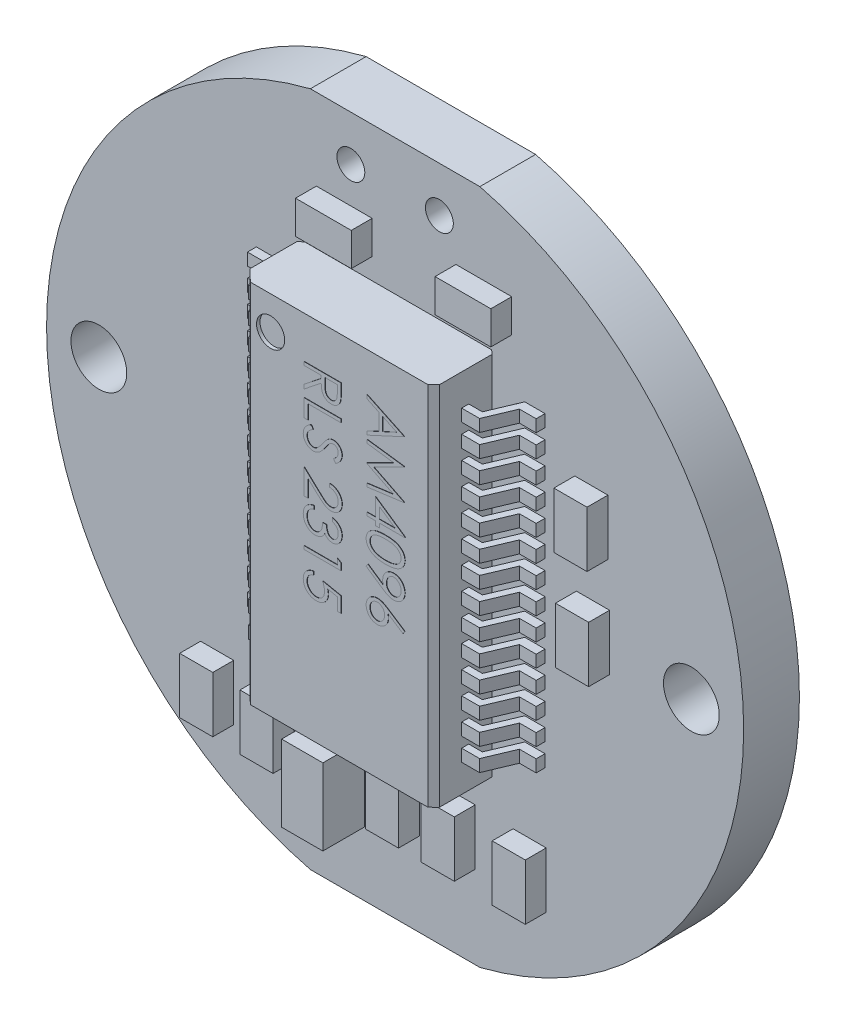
SolidWorks part; units mm, degrees
ref_plane "Plane1" through (0, 0, 0) normal (0, 0, 1) x (1, 0, 0)
ref_plane "Plane2" through (0, 0, 0) normal (0, 1, 0) x (1, 0, 0)
ref_plane "Plane3" through (0, 0, 0) normal (1, 0, 0) x (0, 0, -1)
sketch "Sketch1" plane through (0, 0, 0) normal (0, 0, 1) x (1, 0, 0)
  line L0 (7.9685, 8.8978) -> (9.3019, 8.8978)
  line L1 (7.9685, 9.7978) -> (2.3685, 9.7978)
  line L2 (7.9685, 9.7978) -> (7.9685, 8.8978)
  line L3 (7.9685, -0.7022) -> (2.3685, -0.7022)
  line L4 (2.3685, 9.7978) -> (2.3685, 8.8978)
  line L5 (7.9685, 9.7978) -> (2.3685, -0.7022) construction
  line L6 (7.9685, -0.7022) -> (2.3685, 9.7978) construction
  line L7 (1.0185, 8.8978) -> (2.3685, 8.8978)
  line L8 (1.0185, 8.8978) -> (1.0185, 8.5478)
  line L9 (1.0185, 8.5478) -> (2.3685, 8.5478)
  line L10 (2.3685, 8.5478) -> (2.3685, 8.2478)
  line L11 (7.9685, 8.5478) -> (7.9685, 8.2478)
  line L13 (9.3019, 8.8978) -> (9.3019, 8.5478)
  line L14 (7.9685, 8.5478) -> (9.3019, 8.5478)
  line L16 (7.9685, 7.8978) -> (9.3019, 7.8978)
  line L17 (9.3019, 8.2478) -> (9.3019, 7.8978)
  line L18 (7.9685, 7.5978) -> (9.3019, 7.5978)
  line L19 (7.9685, 7.2478) -> (7.9685, 6.9478)
  line L20 (7.9685, 7.2478) -> (9.3019, 7.2478)
  line L21 (9.3019, 7.5978) -> (9.3019, 7.2478)
  line L22 (7.9685, 6.9478) -> (9.3019, 6.9478)
  line L23 (7.9685, 6.5978) -> (7.9685, 6.2978)
  line L24 (7.9685, 6.5978) -> (9.3019, 6.5978)
  line L25 (9.3019, 6.9478) -> (9.3019, 6.5978)
  line L26 (7.9685, 6.2978) -> (9.3019, 6.2978)
  line L27 (7.9685, 7.8978) -> (7.9685, 7.5978)
  line L28 (7.9685, 5.9478) -> (9.3019, 5.9478)
  line L29 (9.3019, 6.2978) -> (9.3019, 5.9478)
  line L30 (7.9685, 5.6478) -> (9.3019, 5.6478)
  line L31 (7.9685, 5.2978) -> (7.9685, 4.9978)
  line L32 (7.9685, 5.2978) -> (9.3019, 5.2978)
  line L33 (9.3019, 5.6478) -> (9.3019, 5.2978)
  line L34 (7.9685, 4.9978) -> (9.3019, 4.9978)
  line L35 (7.9685, 4.6478) -> (7.9685, 4.3478)
  line L36 (7.9685, 4.6478) -> (9.3019, 4.6478)
  line L37 (9.3019, 4.9978) -> (9.3019, 4.6478)
  line L38 (7.9685, 4.3478) -> (9.3019, 4.3478)
  line L39 (7.9685, 5.9478) -> (7.9685, 5.6478)
  line L40 (7.9685, 3.9978) -> (9.3019, 3.9978)
  line L41 (9.3019, 4.3478) -> (9.3019, 3.9978)
  line L42 (7.9685, 3.6978) -> (9.3019, 3.6978)
  line L43 (7.9685, 3.3478) -> (7.9685, 3.0478)
  line L44 (7.9685, 3.3478) -> (9.3019, 3.3478)
  line L45 (9.3019, 3.6978) -> (9.3019, 3.3478)
  line L46 (7.9685, 3.0478) -> (9.3019, 3.0478)
  line L47 (7.9685, 3.9978) -> (7.9685, 3.6978)
  line L48 (7.9685, 2.6978) -> (9.3019, 2.6978)
  line L49 (9.3019, 3.0478) -> (9.3019, 2.6978)
  line L50 (7.9685, 2.3978) -> (9.3019, 2.3978)
  line L51 (7.9685, 8.2478) -> (9.3019, 8.2478)
  line L52 (7.9685, 2.0478) -> (9.3019, 2.0478)
  line L53 (9.3019, 2.3978) -> (9.3019, 2.0478)
  line L54 (7.9685, 1.7478) -> (9.3019, 1.7478)
  line L55 (7.9685, 0.7478) -> (7.9685, 0.4478)
  line L56 (7.9685, 1.3978) -> (9.3019, 1.3978)
  line L57 (9.3019, 1.7478) -> (9.3019, 1.3978)
  line L58 (7.9685, 1.0978) -> (9.3019, 1.0978)
  line L59 (7.9685, 1.3978) -> (7.9685, 1.0978)
  line L60 (7.9685, 2.0478) -> (7.9685, 1.7478)
  line L61 (9.3019, 1.0978) -> (9.3019, 0.7478)
  line L62 (7.9685, 0.4478) -> (9.3019, 0.4478)
  line L63 (7.9685, 0.0978) -> (7.9685, -0.7022)
  line L64 (7.9685, 0.0978) -> (9.3019, 0.0978)
  line L65 (9.3019, 0.4478) -> (9.3019, 0.0978)
  line L66 (1.0185, 8.2478) -> (2.3685, 8.2478)
  line L67 (1.0185, 8.2478) -> (1.0185, 7.8978)
  line L68 (1.0185, 7.8978) -> (2.3685, 7.8978)
  line L69 (2.3685, 7.8978) -> (2.3685, 7.5978)
  line L70 (1.0185, 7.5978) -> (2.3685, 7.5978)
  line L71 (1.0185, 7.5978) -> (1.0185, 7.2478)
  line L72 (1.0185, 7.2478) -> (2.3685, 7.2478)
  line L73 (2.3685, 7.2478) -> (2.3685, 6.9478)
  line L74 (1.0185, 6.9478) -> (2.3685, 6.9478)
  line L75 (1.0185, 6.9478) -> (1.0185, 6.5978)
  line L76 (1.0185, 6.5978) -> (2.3685, 6.5978)
  line L77 (2.3685, 5.9478) -> (2.3685, 5.6478)
  line L78 (1.0185, 6.2978) -> (2.3685, 6.2978)
  line L79 (1.0185, 6.2978) -> (1.0185, 5.9478)
  line L80 (1.0185, 5.9478) -> (2.3685, 5.9478)
  line L81 (2.3685, 5.2978) -> (2.3685, 4.9978)
  line L82 (1.0185, 5.6478) -> (2.3685, 5.6478)
  line L83 (1.0185, 5.6478) -> (1.0185, 5.2978)
  line L84 (1.0185, 5.2978) -> (2.3685, 5.2978)
  line L85 (2.3685, 4.6478) -> (2.3685, 4.3478)
  line L86 (1.0185, 4.9978) -> (2.3685, 4.9978)
  line L87 (1.0185, 4.9978) -> (1.0185, 4.6478)
  line L88 (1.0185, 4.6478) -> (2.3685, 4.6478)
  line L89 (2.3685, 3.9978) -> (2.3685, 3.6978)
  line L90 (1.0185, 4.3478) -> (2.3685, 4.3478)
  line L91 (1.0185, 4.3478) -> (1.0185, 3.9978)
  line L92 (1.0185, 3.9978) -> (2.3685, 3.9978)
  line L93 (2.3685, 3.3478) -> (2.3685, 3.0478)
  line L94 (1.0185, 3.6978) -> (2.3685, 3.6978)
  line L95 (1.0185, 3.6978) -> (1.0185, 3.3478)
  line L96 (1.0185, 3.3478) -> (2.3685, 3.3478)
  line L97 (2.3685, 2.6978) -> (2.3685, 2.3978)
  line L98 (1.0185, 3.0478) -> (2.3685, 3.0478)
  line L99 (1.0185, 3.0478) -> (1.0185, 2.6978)
  line L100 (1.0185, 2.6978) -> (2.3685, 2.6978)
  line L101 (2.3685, 2.0478) -> (2.3685, 1.7478)
  line L102 (1.0185, 2.3978) -> (2.3685, 2.3978)
  line L103 (1.0185, 2.3978) -> (1.0185, 2.0478)
  line L104 (1.0185, 2.0478) -> (2.3685, 2.0478)
  line L105 (2.3685, 1.3978) -> (2.3685, 1.0978)
  line L106 (1.0185, 1.7478) -> (2.3685, 1.7478)
  line L107 (1.0185, 1.7478) -> (1.0185, 1.3978)
  line L108 (1.0185, 1.3978) -> (2.3685, 1.3978)
  line L109 (2.3685, 0.0978) -> (2.3685, -0.7022)
  line L110 (1.0185, 1.0978) -> (2.3685, 1.0978)
  line L111 (1.0185, 1.0978) -> (1.0185, 0.7478)
  line L112 (1.0185, 0.7478) -> (2.3685, 0.7478)
  line L113 (7.9685, 0.7478) -> (9.3019, 0.7478)
  line L114 (1.0185, 0.4478) -> (2.3685, 0.4478)
  line L115 (1.0185, 0.4478) -> (1.0185, 0.0978)
  line L116 (1.0185, 0.0978) -> (2.3685, 0.0978)
  line L117 (7.9685, 2.6978) -> (7.9685, 2.3978)
  line L118 (2.3685, 6.5978) -> (2.3685, 6.2978)
  line L119 (2.3685, 0.7478) -> (2.3685, 0.4478)
  line L187 (7.4885, 0.4478) -> (7.4885, 0.0978)
  line L188 (7.0185, 0.7478) -> (7.1952, 0.7478)
  line L189 (7.4885, 1.0978) -> (7.4885, 1.079)
  line L190 (7.4885, 1.7478) -> (7.4885, 1.3978)
  line L191 (7.4885, 3.0478) -> (7.4885, 2.6978)
  line L192 (7.4885, 2.3978) -> (7.4885, 2.0478)
  line L193 (7.4885, 3.6978) -> (7.4885, 3.3478)
  line L194 (7.4885, 4.3478) -> (7.4885, 3.9978)
  line L195 (7.4885, 4.9978) -> (7.4885, 4.6478)
  line L196 (7.4885, 5.6478) -> (7.4885, 5.2978)
  line L197 (7.4885, 6.2978) -> (7.4885, 5.9478)
  line L198 (7.4885, 6.9478) -> (7.4885, 6.5978)
  line L199 (7.4885, 7.5978) -> (7.4885, 7.2478)
  line L200 (7.0185, 8.2478) -> (7.1418, 8.2478)
  line L201 (7.4885, 8.0165) -> (7.4885, 7.8978)
  line L202 (7.0185, 8.5478) -> (7.3018, 8.5478)
  line L203 (7.4885, 8.8978) -> (7.4885, 8.5478)
  circle A0 centre (5.1685, 4.5478) radius 0.005
  dimension "D3" = 1.35
  dimension "D1" = 5.6
  dimension "D2" = 10.5
  dimension "D4" = 0.9
  dimension "D5" = 0.35
  dimension "D6" = 2
  dimension "D7" = 14
extrude "Base-Extrude" add sketch "Sketch1" along normal blind 1.86
sketch "Sketch5" plane through (0, 0, 1.86) normal (0, 0, 1) x (1, 0, 0)
  circle A0 centre (3.2885, 8.8458) radius 0.4042
extrude "Cut-Extrude5" cut sketch "Sketch5" against normal blind 0.1
sketch "Sketch15" plane through (0, 9.7978, 0) normal (0, 1, 0) x (1, 0, 0)
  line L0 (1.0185, -0.2554) -> (1.515, -0.2554)
  line L1 (1.0185, -1.86) -> (1.0185, 0) construction
  line L2 (1.515, -0.2554) -> (1.8543, -1.0602)
  line L3 (1.8543, -1.0602) -> (2.3685, -1.0602)
  line L4 (2.3685, -1.86) -> (2.3685, 0) construction
  line L5 (1.6176, 0) -> (1.9784, -0.8559)
  line L6 (2.3685, 0) -> (1.0185, 0) construction
  line L7 (1.9784, -0.8559) -> (2.3685, -0.8559)
  line L8 (2.3685, -0.8559) -> (2.3685, -0.1875)
  line L9 (2.3685, -1.86) -> (2.3685, 0) construction
  line L10 (2.3685, -0.1875) -> (2.4855, -0.0818)
  line L11 (2.4855, -0.0818) -> (7.8515, -0.0818)
  line L13 (7.9685, -1.86) -> (2.3685, -1.86) construction
  line L14 (2.3685, -1.0602) -> (2.3685, -1.5336)
  line L15 (1.0185, -0.2554) -> (0.5525, -0.2554)
  line L16 (0.5525, -0.2554) -> (0.5525, -2.3857)
  line L17 (0.5525, -2.3857) -> (2.6512, -2.3857)
  line L18 (9.7846, -2.3857) -> (7.7471, -2.3896)
  line L19 (9.7846, -0.2554) -> (9.7846, -2.3857)
  line L21 (7.9685, -1.0602) -> (7.9685, -1.6968)
  line L22 (7.9685, -0.1875) -> (7.8515, -0.0818)
  line L23 (7.9685, -0.8559) -> (7.9685, -0.1875)
  line L24 (8.3586, -0.8559) -> (7.9685, -0.8559)
  line L25 (8.7194, 0) -> (8.3586, -0.8559)
  line L26 (8.4827, -1.0602) -> (7.9685, -1.0602)
  line L27 (8.822, -0.2554) -> (8.4827, -1.0602)
  line L28 (9.7846, -0.2554) -> (8.822, -0.2554)
  line L29 (1.6176, 0) -> (8.7194, 0)
  line L30 (2.3685, -1.5336) -> (2.7064, -1.86)
  line L31 (2.7064, -1.86) -> (2.6512, -2.3857)
  line L33 (7.9685, -1.86) -> (7.9685, 0) construction
  line L34 (7.9685, -1.6968) -> (7.8028, -1.86)
  line L35 (7.8028, -1.86) -> (7.7471, -2.3896)
extrude "Cut-Extrude9" cut sketch "Sketch15" against normal blind 11
sketch "Sketch6" plane through (0, 0, 1.86) normal (0, 0, 1) x (1, 0, 0)
  line L0 (6.0658, 8.7382) -> (6.0658, 0.6216) construction
  text T0 "AM4096  RLS 2315" font "Century Gothic" height in points 4
extrude "Boss-Extrude1" add sketch "Sketch6" along normal blind 0.01
sketch "Sketch7" plane through (0, 0, 0) normal (0, 0, -1) x (-1, 0, 0)
  line L0 (-15, 5.0018) -> (5, 5.0018) construction
  line L1 (-5, 5.0018) -> (-5, 19.2518) construction
  line L2 (-19.25, 19.2518) -> (9.25, 19.2518) construction
  line L3 (-19.25, 19.2518) -> (-19.25, -9.2482) construction
  line L4 (-19.25, -9.2482) -> (9.25, -9.2482) construction
  line L5 (9.25, 19.2518) -> (9.25, -9.2482) construction
  line L6 (-5, 5.0018) -> (9.25, 5.0018) construction
  line L7 (-19.25, 19.2518) -> (9.25, -9.2482) construction
  line L8 (-19.25, -9.2482) -> (9.25, 19.2518) construction
  line L9 (3.5, 3.9018) -> (-13.5, 3.9018) construction
  line L10 (-2.569, 13.6018) -> (-7.431, 13.6018)
  line L11 (-2.569, -5.7982) -> (-7.431, -5.7982)
  circle A0 centre (-5, 5.0018) radius 10 construction
  circle A1 centre (-13.5, 5.0018) radius 0.1397 construction
  circle A2 centre (3.5, 5.0018) radius 0.8 construction
  circle A3 centre (-5, 5.0018) radius 15.5 construction
  circle A4 centre (-15.9602, 15.9619) radius 1.25 construction
  circle A5 centre (5.9602, 15.9619) radius 1.25 construction
  circle A6 centre (5.9602, -5.9584) radius 1.25 construction
  circle A7 centre (-15.9602, -5.9584) radius 1.25 construction
  circle A8 centre (5.9602, 15.9619) radius 0.75 construction
  circle A9 centre (-15.9602, -5.9584) radius 0.75 construction
  arc A10 (-2.569, -5.7982) -> (-2.569, 13.6018) centre (-5, 3.9018) ccw
  circle A11 centre (3.5, 3.9018) radius 0.8
  circle A12 centre (-13.5, 3.9018) radius 0.8
  arc A13 (-7.431, 13.6018) -> (-7.431, -5.7982) centre (-5, 3.9018) ccw
  circle A14 centre (-6.27, 12.3018) radius 0.4
  circle A15 centre (-3.73, 12.3018) radius 0.4
  dimension "D1" = 2.5
  dimension "D2" = 4
  dimension "D3" = 0.5
  dimension "D4" = 0.5
  dimension "D5" = 20
  dimension "D8" = 20
  dimension "D9" = 1.1
  dimension "D11" = 1.6
  dimension "D13" = 9.7
  dimension "D15" = 2.54
  dimension "D17" = 0.8
  dimension "D6" = 28.5
  dimension "D7" = 28.5
  dimension "D10" = 17
  dimension "D12" = 1.1
  dimension "D14" = 9.7
  dimension "D16" = 8.4
extrude "Extrude1" add sketch "Sketch7" along normal blind 1.6
sketch "Sketch12" plane through (0, 0, 0) normal (0, 0, 1) x (1, 0, 0)
  line L0 (2.944, -1.768) -> (4.1264, -1.768)
  line L1 (2.944, -1.768) -> (2.944, -3.9585)
  line L2 (2.944, -3.9585) -> (4.1264, -3.9585)
  line L3 (4.1264, -1.768) -> (4.1264, -3.9585)
  line L4 (2.7418, 11.2698) -> (4.3418, 11.2698)
  line L5 (2.7418, 11.2698) -> (2.7418, 10.3198)
  line L6 (2.7418, 10.3198) -> (4.3418, 10.3198)
  line L7 (4.3418, 11.2698) -> (4.3418, 10.3198)
  line L8 (-0.581, -1.6996) -> (0.369, -1.6996)
  line L9 (-0.581, -1.6996) -> (-0.581, -3.2996)
  line L10 (-0.581, -3.2996) -> (0.369, -3.2996)
  line L11 (0.369, -1.6996) -> (0.369, -3.2996)
  line L12 (1.1481, -1.7456) -> (2.0981, -1.7456)
  line L13 (1.1481, -1.7456) -> (1.1481, -3.3456)
  line L14 (1.1481, -3.3456) -> (2.0981, -3.3456)
  line L15 (2.0981, -1.7456) -> (2.0981, -3.3456)
  line L20 (10.155, 7.7742) -> (11.105, 7.7742)
  line L21 (10.155, 7.7742) -> (10.155, 6.1742)
  line L22 (10.155, 6.1742) -> (11.105, 6.1742)
  line L23 (11.105, 7.7742) -> (11.105, 6.1742)
  line L24 (8.3848, -1.8767) -> (9.3348, -1.8767)
  line L25 (8.3848, -1.8767) -> (8.3848, -3.4767)
  line L26 (8.3848, -3.4767) -> (9.3348, -3.4767)
  line L27 (9.3348, -1.8767) -> (9.3348, -3.4767)
  line L28 (4.7475, -1.8) -> (5.6975, -1.8)
  line L29 (4.7475, -1.8) -> (4.7475, -3.4)
  line L30 (4.7475, -3.4) -> (5.6975, -3.4)
  line L31 (5.6975, -1.8) -> (5.6975, -3.4)
  line L32 (6.3483, -1.8248) -> (7.2983, -1.8248)
  line L33 (6.3483, -1.8248) -> (6.3483, -3.4248)
  line L34 (6.3483, -3.4248) -> (7.2983, -3.4248)
  line L35 (7.2983, -1.8248) -> (7.2983, -3.4248)
  line L36 (6.7455, 11.3247) -> (8.3455, 11.3247)
  line L37 (6.7455, 11.3247) -> (6.7455, 10.3747)
  line L38 (6.7455, 10.3747) -> (8.3455, 10.3747)
  line L39 (8.3455, 11.3247) -> (8.3455, 10.3747)
  line L40 (10.2015, 4.9366) -> (11.1515, 4.9366)
  line L41 (10.2015, 4.9366) -> (10.2015, 3.3366)
  line L42 (10.2015, 3.3366) -> (11.1515, 3.3366)
  line L43 (11.1515, 4.9366) -> (11.1515, 3.3366)
  dimension "D1" = 1.6
  dimension "D2" = 0.95
extrude "Extrude6" add sketch "Sketch12" along normal blind 0.6
sketch "Sketch14" plane through (0, 0, -1.6) normal (0, 0, -1) x (-1, 0, 0)
  line L0 (3.5, 2.4018) -> (3.5, 5.4018) construction
  line L1 (-11.0073, -0.7594) -> (-9.9073, -0.7594)
  line L2 (-11.0073, -0.7594) -> (-11.0073, -3.2594)
  line L3 (-11.0073, -3.2594) -> (-9.9073, -3.2594)
  line L4 (-9.9073, -0.7594) -> (-9.9073, -3.2594)
  line L5 (2.3, 2.4018) -> (2.3, 5.4018)
  line L6 (-9.5073, -0.7594) -> (-8.4073, -0.7594)
  line L7 (-9.5073, -0.7594) -> (-9.5073, -3.2594)
  line L8 (-9.5073, -3.2594) -> (-8.4073, -3.2594)
  line L9 (-8.4073, -0.7594) -> (-8.4073, -3.2594)
  line L10 (-8.0073, -0.7594) -> (-6.9073, -0.7594)
  line L11 (-8.0073, -0.7594) -> (-8.0073, -3.2594)
  line L12 (-8.0073, -3.2594) -> (-6.9073, -3.2594)
  line L13 (-6.9073, -0.7594) -> (-6.9073, -3.2594)
  line L14 (-6.5073, -0.7594) -> (-5.4073, -0.7594)
  line L15 (-6.5073, -0.7594) -> (-6.5073, -3.2594)
  line L16 (-6.5073, -3.2594) -> (-5.4073, -3.2594)
  line L17 (-5.4073, -0.7594) -> (-5.4073, -3.2594)
  line L18 (-5.0073, -0.7594) -> (-3.9073, -0.7594)
  line L19 (-5.0073, -0.7594) -> (-5.0073, -3.2594)
  line L20 (-5.0073, -3.2594) -> (-3.9073, -3.2594)
  line L21 (-3.9073, -0.7594) -> (-3.9073, -3.2594)
  line L22 (-3.5073, -0.7594) -> (-2.4073, -0.7594)
  line L23 (-3.5073, -0.7594) -> (-3.5073, -3.2594)
  line L24 (-3.5073, -3.2594) -> (-2.4073, -3.2594)
  line L25 (-2.4073, -0.7594) -> (-2.4073, -3.2594)
  line L30 (-13.5, 2.4018) -> (-13.5, 5.4018) construction
  line L31 (-14.7, 2.4018) -> (-14.7, 5.4018)
  line L32 (-12.3, 2.4018) -> (-12.3, 5.4018)
  line L33 (-5, 3.9018) -> (-5, 8.8363) construction
  line L34 (4.7, 2.4018) -> (4.7, 5.4018)
  line L35 (-2.0073, -0.7594) -> (-0.9073, -0.7594)
  line L36 (-2.0073, -0.7594) -> (-2.0073, -3.2594)
  line L37 (-2.0073, -3.2594) -> (-0.9073, -3.2594)
  line L38 (-0.9073, -0.7594) -> (-0.9073, -3.2594)
  arc A0 (2.3, 2.4018) -> (4.7, 2.4018) centre (3.5, 2.4018) ccw
  arc A1 (4.7, 5.4018) -> (2.3, 5.4018) centre (3.5, 5.4018) ccw
  circle A3 centre (-13.5, 3.9018) radius 0.8
  circle A4 centre (-13.5, 3.9018) radius 0.8
  arc A5 (-14.7, 2.4018) -> (-12.3, 2.4018) centre (-13.5, 2.4018) ccw
  circle A6 centre (3.5, 3.9018) radius 0.8
  circle A7 centre (3.5, 3.9018) radius 0.8
  arc A8 (-12.3, 5.4018) -> (-14.7, 5.4018) centre (-13.5, 5.4018) ccw
  point P34 (-13.5, 3.9018)
  point P45 (3.5, 3.9018)
  dimension "D8" = 3
  dimension "D7" = 1.2
  dimension "D1" = 7
  dimension "D2" = 1.5
  dimension "D3" = 2.5
  dimension "D4" = 1.1
  dimension "D6" = 0
  dimension "D5" = 0
extrude "Boss-Extrude2" add sketch "Sketch14" along normal blind 0.05
sketch "Sketch18" plane through (0, 0, 0.6) normal (0, 0, 1) x (1, 0, 0)
  line L8 (2.944, -1.768) -> (2.944, -3.9585)
  line L9 (2.944, -3.9585) -> (4.1264, -3.9585)
  line L10 (4.1264, -3.9585) -> (4.1264, -1.768)
  line L11 (4.1264, -1.768) -> (2.944, -1.768)
  line L12 (2.944, -1.768) -> (2.944, -3.9585)
  line L13 (2.944, -3.9585) -> (4.1264, -3.9585)
  line L14 (4.1264, -3.9585) -> (4.1264, -1.768)
  line L15 (4.1264, -1.768) -> (2.944, -1.768)
  dimension "D1" = 0
extrude "Boss-Extrude4" add sketch "Sketch18" along normal blind 0.6
sketch "Sketch19" plane through (0, 0, -1.6) normal (0, 0, -1) x (-1, 0, 0)
  line L108 (-6.0833, 2.8224) -> (-6.0833, 3.2474)
  line L109 (-7.1993, 3.6474) -> (-7.1993, 3.2474)
  line L110 (-7.1993, 4.8974) -> (-7.1993, 4.4974)
  line L111 (-6.0833, 3.6474) -> (-6.0833, 4.4974)
  line L112 (-6.0833, 4.8974) -> (-6.0833, 5.7474)
  line L113 (-7.1993, 6.1474) -> (-7.1993, 5.7474)
  line L114 (-6.0833, 6.1474) -> (-6.0833, 6.9974)
  line L115 (-7.1993, 7.3974) -> (-7.1993, 6.9974)
  line L116 (-6.0833, 7.3974) -> (-6.0833, 7.8224)
  line L117 (-2.0996, 7.8224) -> (-2.0996, 7.3974)
  line L118 (-0.9993, 7.3974) -> (-0.9993, 6.9974)
  line L119 (-2.0996, 6.9974) -> (-2.0996, 6.1474)
  line L120 (-0.9993, 6.1474) -> (-0.9993, 5.7474)
  line L121 (-2.0996, 5.7474) -> (-2.0996, 4.8974)
  line L122 (-0.9993, 4.8974) -> (-0.9993, 4.4974)
  line L123 (-2.0996, 4.4974) -> (-2.0996, 3.6474)
  line L124 (-0.9993, 3.6474) -> (-0.9993, 3.2474)
  line L125 (-2.0996, 3.2474) -> (-2.0996, 2.8224)
  line L126 (-2.0996, 7.8224) -> (-6.0833, 7.8224)
  line L127 (-2.0996, 2.8224) -> (-6.0833, 2.8224)
  line L128 (-6.0833, 4.8974) -> (-7.1993, 4.8974)
  line L129 (-7.1993, 3.2474) -> (-6.0833, 3.2474)
  line L130 (-6.0833, 3.6474) -> (-7.1993, 3.6474)
  line L131 (-7.1993, 4.4974) -> (-6.0833, 4.4974)
  line L132 (-7.1993, 5.7474) -> (-6.0833, 5.7474)
  line L133 (-6.0833, 6.1474) -> (-7.1993, 6.1474)
  line L134 (-7.1993, 6.9974) -> (-6.0833, 6.9974)
  line L135 (-6.0833, 7.3974) -> (-7.1993, 7.3974)
  line L136 (-0.9993, 3.2474) -> (-2.0996, 3.2474)
  line L137 (-2.0996, 3.6474) -> (-0.9993, 3.6474)
  line L138 (-0.9993, 4.4974) -> (-2.0996, 4.4974)
  line L139 (-2.0996, 4.8974) -> (-0.9993, 4.8974)
  line L140 (-0.9993, 5.7474) -> (-2.0996, 5.7474)
  line L141 (-2.0996, 6.1474) -> (-0.9993, 6.1474)
  line L142 (-0.9993, 6.9974) -> (-2.0996, 6.9974)
  line L143 (-2.0996, 7.3974) -> (-0.9993, 7.3974)
extrude "Boss-Extrude5" add sketch "Sketch19" along normal blind 1.7
sketch "Sketch20" plane through (0, 2.8224, 0) normal (0, -1, 0) x (1, 0, 0)
  line L0 (2.0996, -3.3) -> (2.0996, -1.6) construction
  line L1 (6.0833, -3.3) -> (6.0833, -1.6) construction
  line L2 (-5, -1.6) -> (2.569, -1.6) construction
  line L22 (6.6964, -1.6) -> (1.5522, -1.6)
  line L23 (7.4317, -1.8504) -> (7.4317, -4.1802)
  line L24 (7.4317, -4.1802) -> (0.6061, -4.1802)
  line L25 (0.6061, -4.1802) -> (0.6061, -1.8504)
  line L26 (2.1993, -3.3539) -> (5.6993, -3.3539)
  line L27 (6.6993, -2.5039) -> (6.0833, -2.5039)
  line L28 (1.5495, -2.5039) -> (2.0996, -2.5039)
  line L29 (6.0833, -2.196) -> (6.4777, -2.196)
  line L30 (6.0833, -1.8504) -> (6.0833, -2.196)
  line L31 (6.0833, -2.9679) -> (5.6993, -3.3539)
  line L32 (6.0833, -1.8504) -> (2.0996, -1.8504)
  line L33 (2.0996, -1.8504) -> (2.0996, -2.196)
  line L34 (2.0996, -2.7576) -> (2.1993, -3.3539)
  line L35 (6.4777, -2.196) -> (6.6964, -1.6)
  line L36 (6.6993, -2.5039) -> (6.9391, -1.8504)
  line L37 (6.9391, -1.8504) -> (7.4317, -1.8504)
  line L38 (1.5495, -2.5039) -> (1.2713, -1.8504)
  line L39 (1.2713, -1.8504) -> (0.6061, -1.8504)
  line L40 (2.0996, -2.196) -> (1.7578, -2.196)
  line L41 (1.7578, -2.196) -> (1.5522, -1.6)
  line L42 (6.0833, -2.5039) -> (6.0833, -2.9679)
  line L43 (2.0996, -2.5039) -> (2.0996, -2.7576)
extrude "Cut-Extrude10" cut sketch "Sketch20" against normal blind 8
sketch "Sketch21" plane through (0, 0, -1.6) normal (0, 0, -1) x (-1, 0, 0)
  line L1 (-9.0378, 7.2175) -> (-8.1378, 7.2175)
  line L2 (-9.0378, 7.2175) -> (-9.0378, 5.6175)
  line L3 (-9.0378, 5.6175) -> (-8.1378, 5.6175)
  line L4 (-8.1378, 7.2175) -> (-8.1378, 5.6175)
  line L5 (-8.0569, 2.092) -> (-6.4569, 2.092)
  line L6 (-8.0569, 2.092) -> (-8.0569, 1.192)
  line L7 (-8.0569, 1.192) -> (-6.4569, 1.192)
  line L8 (-6.4569, 2.092) -> (-6.4569, 1.192)
  line L9 (-4.5007, 2.0646) -> (-2.9007, 2.0646)
  line L10 (-4.5007, 2.0646) -> (-4.5007, 1.1646)
  line L11 (-4.5007, 1.1646) -> (-2.9007, 1.1646)
  line L12 (-2.9007, 2.0646) -> (-2.9007, 1.1646)
  line L13 (-10.9788, 3.5236) -> (-9.4189, 3.5236)
  line L14 (-10.9788, 3.5236) -> (-10.9788, 1.192)
  line L15 (-10.9788, 1.192) -> (-9.4189, 1.192)
  line L16 (-9.4189, 3.5236) -> (-9.4189, 1.192)
  dimension "D1" = 1.6
  dimension "D2" = 0.9
extrude "Boss-Extrude6" add sketch "Sketch21" along normal blind 0.6
equation "\"1.8¸6\"=1.8"
equation "\"¸1.25\"=0.876516"
